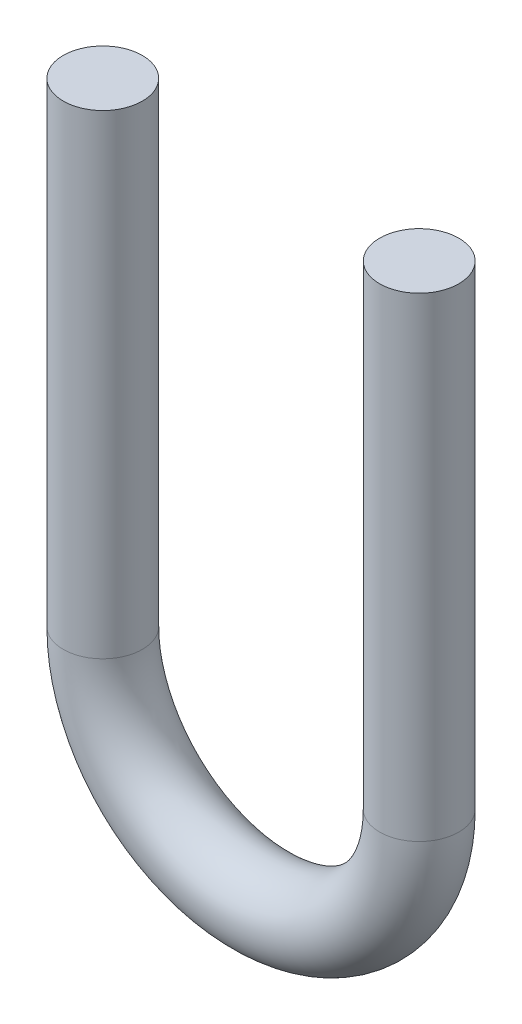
SolidWorks part; units mm, degrees
ref_plane "Front Plane" through (0, 0, 0) normal (0, 0, 1) x (1, 0, 0)
ref_plane "Top Plane" through (0, 0, 0) normal (0, 1, 0) x (1, 0, 0)
ref_plane "Right Plane" through (0, 0, 0) normal (1, 0, 0) x (0, 0, -1)
sketch "Sketch1" plane through (0, 0, 0) normal (0, 0, 1) x (1, 0, 0)
  line L0 (-32.4467, -9.2519) -> (-32.4467, 0.2731)
  line L1 (-26.0967, 0.2731) -> (-26.0967, -9.2519)
  arc A0 (-32.4467, -9.2519) -> (-26.0967, -9.2519) centre (-29.2717, -9.2519) ccw
  dimension "D1" = 9.525
  dimension "D2" = 9.525
  dimension "D3" = 6.35
curve "CompCurve1"
ref_plane "Plane2" through (-32.4467, 0.2731, 0) normal (0, -1, 0) x (1, 0, 0)
sketch "Sketch2" plane through (-32.4467, 0.2731, 0) normal (0, -1, 0) x (1, 0, 0)
  circle A0 centre (0.0013, 0) radius 0.7937
  dimension "D1" = 1.5875
sweep "Sweep1" add profiles "Sketch2" path "CompCurve1"
